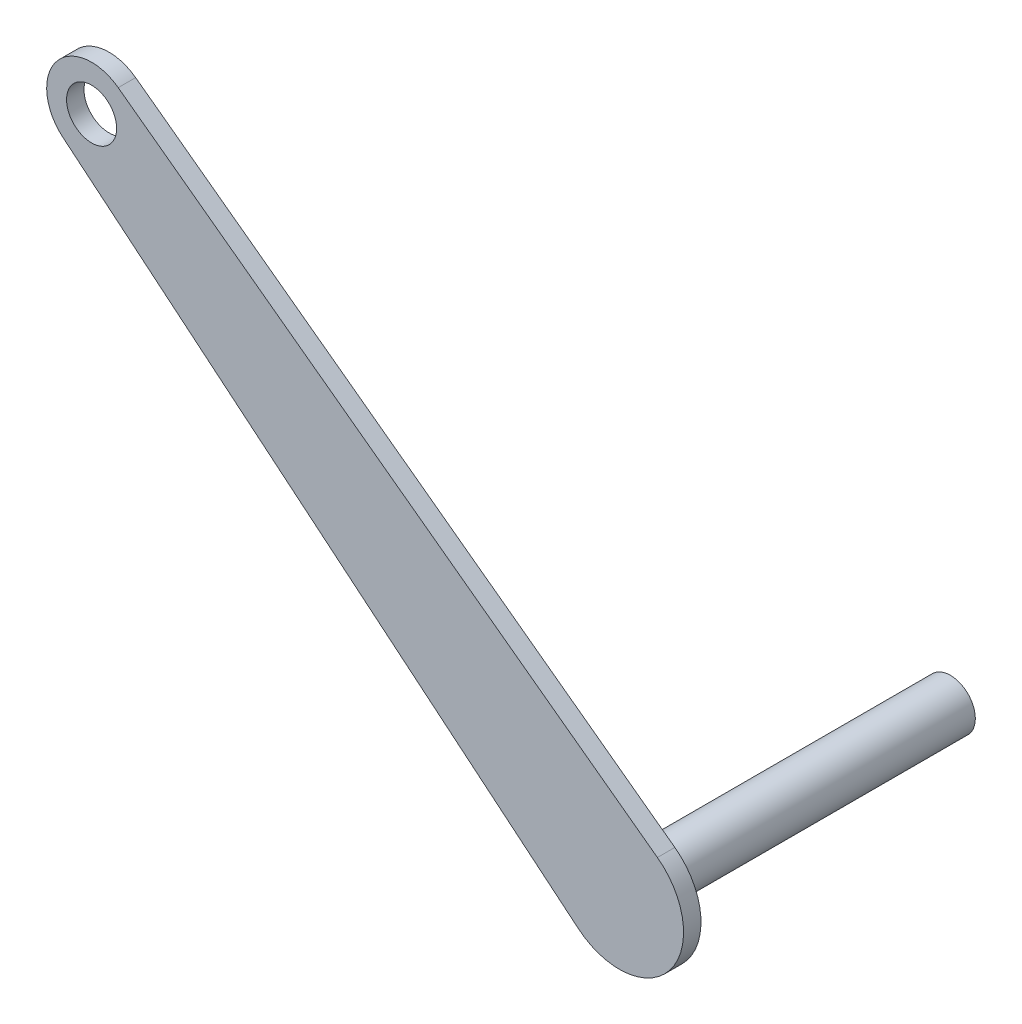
SolidWorks part; units mm, degrees
ref_plane "Front Plane" through (0, 0, 0) normal (0, 0, 1) x (1, 0, 0)
ref_plane "Top Plane" through (0, 0, 0) normal (0, 1, 0) x (1, 0, 0)
ref_plane "Right Plane" through (0, 0, 0) normal (1, 0, 0) x (0, 0, -1)
sketch "Sketch1" plane through (0, 0, 0) normal (0, 0, 1) x (1, 0, 0)
sketch_block_instance "Block2-1"
sketch_block "Block2"
extrude "Extrude1" add sketch "Sketch1" along normal blind 3
sketch "Sketch2" plane through (0, 0, 3) normal (0, 0, 1) x (1, 0, 0)
  circle A0 centre (74.3158, -16.7654) radius 4.3097 construction
  circle A1 centre (74.3158, -16.7654) radius 4.3097
extrude "Extrude2" add sketch "Sketch2" against normal blind 57
sketch "Sketch3" plane through (0, 0, 0) normal (0, 0, -1) x (-1, 0, 0)
  point P0 (16.5781, 54.2992)
